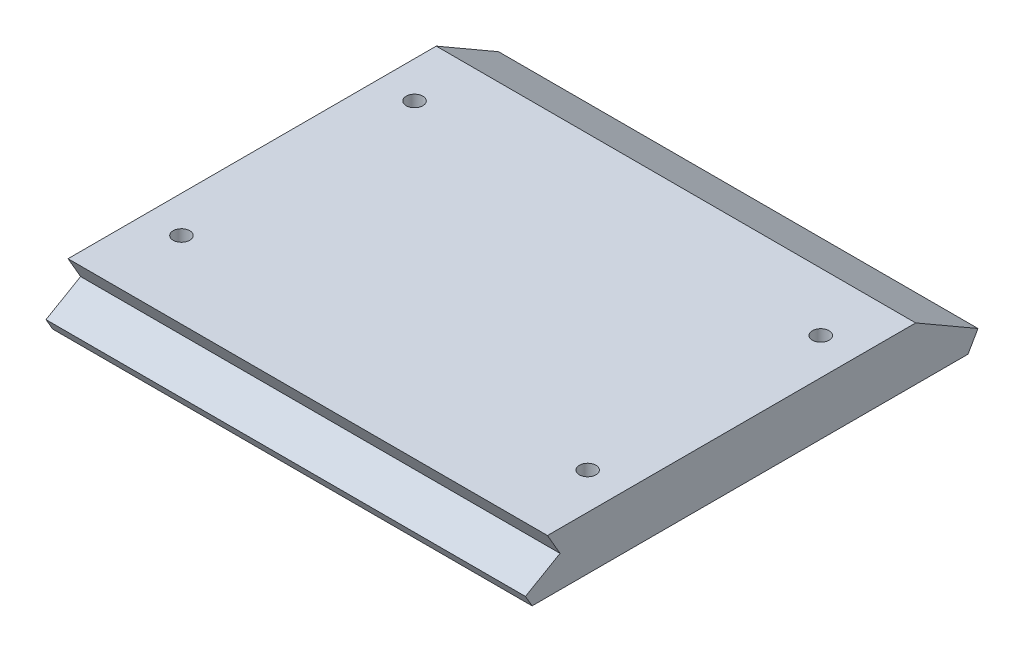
SolidWorks part; units mm, degrees
ref_plane "Front Plane" through (0, 0, 0) normal (0, 0, 1) x (1, 0, 0)
ref_plane "Top Plane" through (0, 0, 0) normal (0, 1, 0) x (1, 0, 0)
ref_plane "Right Plane" through (0, 0, 0) normal (1, 0, 0) x (0, 0, -1)
sketch "Sketch1" plane through (0, 0, 0) normal (1, 0, 0) x (0, 0, -1)
  line L0 (0, 0) -> (65.46, 0)
  line L1 (65.46, 0) -> (66.96, 2.5981)
  line L2 (66.96, 2.5981) -> (57.6036, 8)
  line L3 (0, 0) -> (-1, 1.7321)
  line L4 (-1, 1.7321) -> (4.1962, 4.7321)
  line L5 (4.1962, 4.7321) -> (2.3094, 8)
  line L7 (2.3094, 8) -> (57.6036, 8)
  dimension "D1" = 65.46
  dimension "D2" = 120
  dimension "D3" = 90
  dimension "D4" = 2
  dimension "D5" = 120
  dimension "D6" = 6
  dimension "D7" = 8
  dimension "D8" = 3
extrude "Boss-Extrude1" add sketch "Sketch1" along normal mid plane 72
hole_wizard "M3x0.5 Tapped Hole1" positions "Sketch3" profile "Sketch2" tap size "M3x0.5" standard "ANSI Metric"
sketch "Sketch3" plane through (0, 8, 0) normal (0, 1, 0) x (1, 0, 0)
  point P0 (30.5, 13.8412)
  point P3 (30.5, 48.8412)
  point P6 (-30.5, 13.8412)
  point P9 (-30.5, 48.8412)
sketch "Sketch2" plane through (30.5, 8, -13.8412) normal (1, 0, 0) x (0, 0, 1)
  line L0 (0, 0) -> (0, 7.2511)
  line L1 (0, 7.2511) -> (1.25, 6.5)
  line L2 (1.25, 6.5) -> (1.25, 0)
  line L5 (1.25, 0) -> (0, 0)
  line L10 (0, 7.2511) -> (-1.25, 6.5) construction
  line L11 (0, -6.35) -> (0, 107.95) construction
  dimension "Tap Drill Dia." = 2.5
  dimension "Tap Drill Depth" = 6.5
  dimension "Drill Angle" = 118
